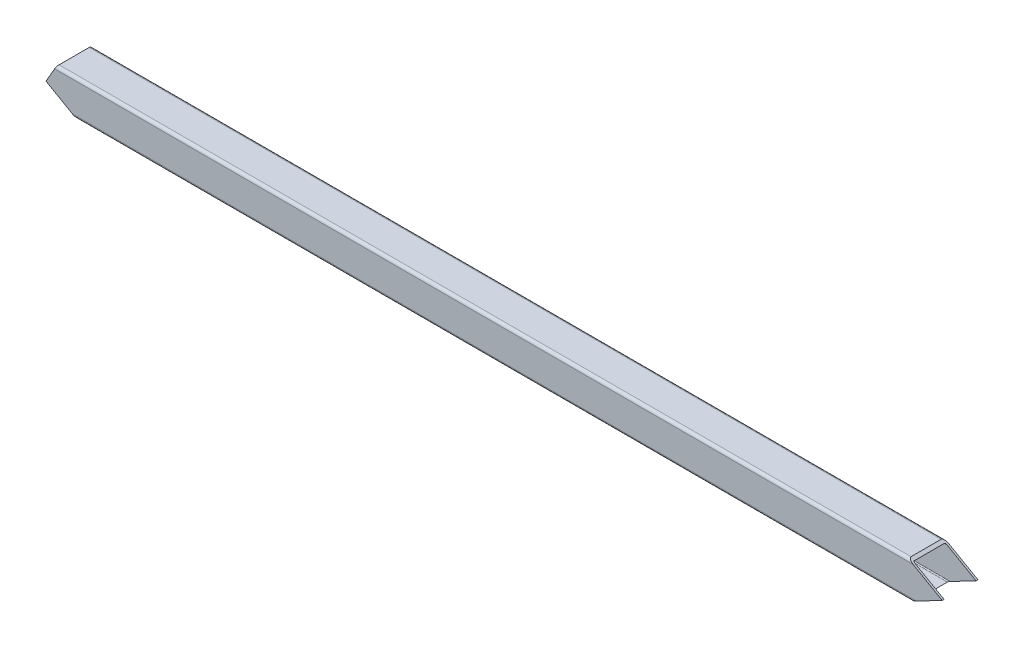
SolidWorks part; units mm, degrees
ref_plane "Front Plane" through (0, 0, 0) normal (0, 0, 1) x (1, 0, 0)
ref_plane "Top Plane" through (0, 0, 0) normal (0, 1, 0) x (1, 0, 0)
ref_plane "Right Plane" through (0, 0, 0) normal (1, 0, 0) x (0, 0, -1)
sketch "Sketch1" plane through (0, 0, 0) normal (1, 0, 0) x (0, 0, -1)
  line L0 (0, 2.54) -> (0, 29.21)
  line L1 (-2.54, 31.75) -> (-29.21, 31.75)
  line L2 (-31.75, 29.21) -> (-31.75, 2.54)
  line L3 (-29.21, 0) -> (-2.54, 0)
  line L4 (-1.651, 2.54) -> (-1.651, 29.21)
  line L5 (-2.54, 30.099) -> (-29.21, 30.099)
  line L6 (-30.099, 29.21) -> (-30.099, 2.54)
  line L7 (-29.21, 1.651) -> (-2.54, 1.651)
  arc A0 (-31.75, 2.54) -> (-29.21, 0) centre (-29.21, 2.54) ccw
  arc A1 (0, 2.54) -> (-2.54, 0) centre (-2.54, 2.54) cw
  arc A2 (0, 29.21) -> (-2.54, 31.75) centre (-2.54, 29.21) ccw
  arc A3 (-31.75, 29.21) -> (-29.21, 31.75) centre (-29.21, 29.21) cw
  arc A4 (-1.651, 29.21) -> (-2.54, 30.099) centre (-2.54, 29.21) ccw
  arc A5 (-30.099, 29.21) -> (-29.21, 30.099) centre (-29.21, 29.21) cw
  arc A6 (-30.099, 2.54) -> (-29.21, 1.651) centre (-29.21, 2.54) ccw
  arc A7 (-1.651, 2.54) -> (-2.54, 1.651) centre (-2.54, 2.54) cw
  point P12 (0, 0)
  point P15 (0, 31.75)
  point P18 (-31.75, 31.75)
  dimension "D3" = 2.54
  dimension "D1" = 31.75
  dimension "D2" = 31.75
  dimension "D4" = 1.651
extrude "Boss-Extrude1" add sketch "Sketch1" along normal blind 1016
sketch "Sketch2" plane through (0, 0, 0) normal (-1, 0, 0) x (0, 0, 1)
  line L0 (0, 15.875) -> (31.75, 15.875)
  line L1 (0, 2.54) -> (0, 29.21) construction
  line L2 (31.75, 29.21) -> (31.75, 2.54) construction
sketch "Sketch4" plane through (0, 0, 31.75) normal (0, 0, 1) x (1, 0, 0)
  line L4 (801.795, 10.6988) -> (195.5219, 357.5925) construction
  line L5 (745.815, 42.7291) -> (869.0597, 258.1262)
  line L6 (869.0597, 258.1262) -> (1152.33, 96.0463)
  line L7 (1152.33, 96.0463) -> (991.3822, -185.2454)
  line L10 (380.3596, -201.7569) -> (795.1928, 14.4764) construction
  line L11 (698.9619, -35.6843) -> (991.3822, -185.2454)
  line L12 (0, 29.21) -> (0, 2.54) construction
  line L14 (729.9477, -19.5328) -> (795.1928, 14.4764)
  line L15 (729.9477, -19.5328) -> (698.9619, -35.6843)
  line L17 (745.815, 42.7291) -> (795.1928, 14.4764)
  dimension "D1" = 698.9619
  dimension "D2" = 745.815
  dimension "D3" = 1152.33
  dimension "D4" = 869.0597
  dimension "D5" = 991.3822
  dimension "D6" = 729.9477
extrude "Cut-Extrude5" cut sketch "Sketch4" against normal blind 38.1 contours L6 L7 L11 L15 L14 L17 L5
sketch "Sketch5" plane through (0, 0, 31.75) normal (0, 0, 1) x (1, 0, 0)
  line L2 (0, 29.21) -> (0, 2.54) construction
  line L5 (765.0034, 31.75) -> (0, 31.75) construction
  line L6 (0, 15.875) -> (9.0936, 31.75)
  line L7 (0, 36.9591) -> (-17.4058, 6.5734)
  line L8 (-17.4058, 6.5734) -> (26.9735, -18.8483)
  line L10 (0, 36.9591) -> (9.0936, 31.75)
  line L11 (0, 15.875) -> (34.7064, -3.9831)
  line L12 (424.3911, -226.9506) -> (0, 15.875) construction
  line L13 (34.7064, -3.9831) -> (26.9735, -18.8483)
  dimension "D1" = 9.0936
  dimension "D2" = 26.9735
  dimension "D3" = 34.7064
  dimension "D4" = 17.4058
extrude "Cut-Extrude6" cut sketch "Sketch5" against normal blind 38.1
